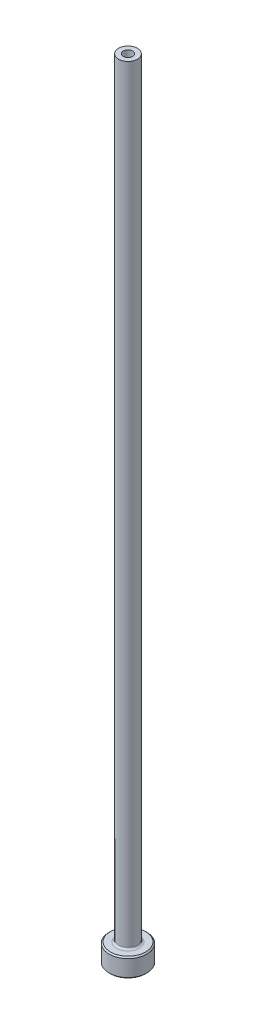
SolidWorks part; units mm, degrees
ref_plane "Front Plane" through (0, 0, 0) normal (0, 0, 1) x (1, 0, 0)
ref_plane "Top Plane" through (0, 0, 0) normal (0, 1, 0) x (1, 0, 0)
ref_plane "Right Plane" through (0, 0, 0) normal (1, 0, 0) x (0, 0, -1)
sketch "Sketch1" plane through (0, 0, 0) normal (0, 0, 1) x (1, 0, 0)
  line L0 (-0.75, 125) -> (-1.5, 125)
  line L1 (-1.5, 125) -> (-1.5, 3)
  line L2 (-1.5, 3) -> (-3, 3)
  line L3 (-3, 3) -> (-3, 0)
  line L4 (3.3, 0) -> (-3.3, 0) construction
  line L5 (-3, 0) -> (-1, 0)
  line L6 (-0.75, 90) -> (-0.75, 125)
  line L7 (0, 92.1877) -> (0, -15.5353) construction
  line L8 (0, -3.3) -> (0, 3.3) construction
  line L9 (-0.75, 90) -> (-1, 78)
  line L10 (-1, 78) -> (-1, 0)
  dimension "D1" = 0.25
  dimension "ID" = 1.5
  dimension "OD" = 3
  dimension "L" = 125
  dimension "H" = 6
  dimension "T" = 3
  dimension "N" = 35
  dimension "D2" = 12
revolve "Revolve1" add sketch "Sketch1" angle 360 about L7
fillet "Fillet1" radius 0.3 1 edges at (0, 3, 1.5)
chamfer "Chamfer1" distance 0.2 angle 45 2 edges at (0, 3, 3) (0, 0, 3)
chamfer "Chamfer3" distance 0.5 angle 45 1 edges at (0, 0, 1)
